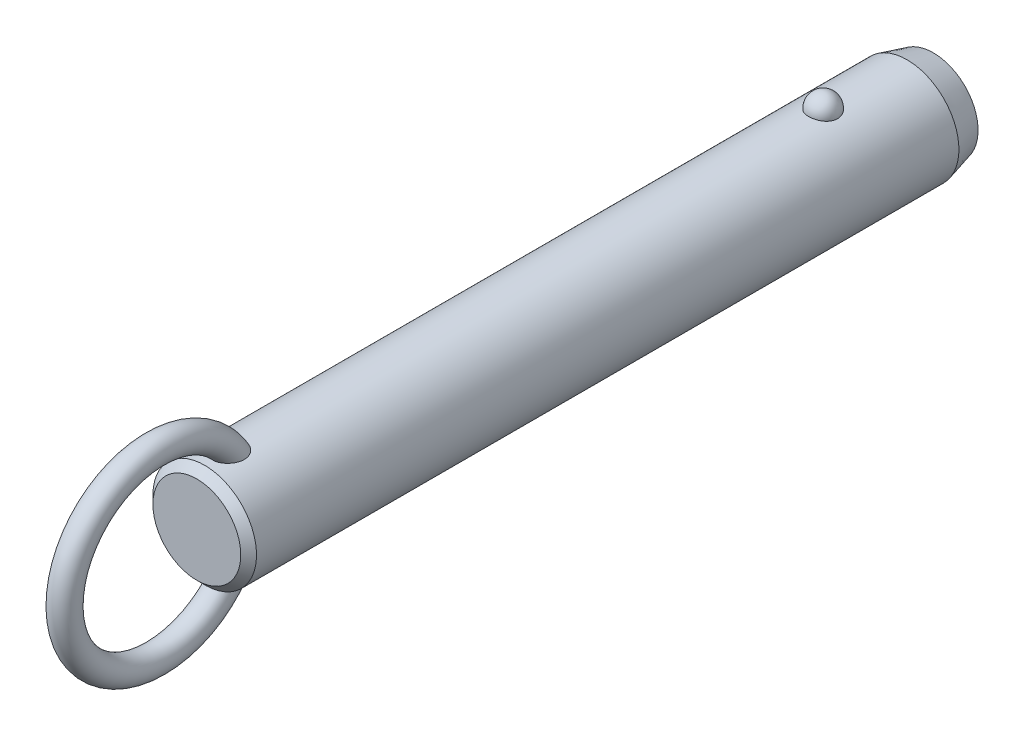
SolidWorks part; units mm, degrees
ref_plane "Front Plane" through (0, 0, 0) normal (0, 0, 1) x (1, 0, 0)
ref_plane "Top Plane" through (0, 0, 0) normal (0, 1, 0) x (1, 0, 0)
ref_plane "Right Plane" through (0, 0, 0) normal (1, 0, 0) x (0, 0, -1)
sketch "Sketch2" plane through (0, 0, 0) normal (0, 0, 1) x (1, 0, 0)
  circle A0 centre (0, 0) radius 7.9
  point P3 (0, 7.9)
  dimension "D1" = 15.8
extrude "Boss-Extrude1" add sketch "Sketch2" along normal blind 83.8
sketch "Sketch3" plane through (0, 0, 0) normal (0, 0, -1) x (-1, 0, 0)
  circle A0 centre (0, 0) radius 7.9
  dimension "D1" = 15.8
extrude "Boss-Extrude2" add sketch "Sketch3" along normal blind 19
chamfer "Chamfer1" distance 4 angle 15 1 edges at (-7.9, 0, -19)
sketch "Sketch12" plane through (0, 0, 0) normal (1, 0, 0) x (0, 0, -1)
  line L0 (-83.8, 7.9) -> (-83.8, -7.9) construction
  point P0 (-83.8, 0)
sketch "Sketch13" plane through (0, 0, 0) normal (1, 0, 0) x (0, 0, -1)
  circle A0 centre (-99.65, 0) radius 15.85
  point P2 (-83.8, 0)
  dimension "D1" = 31.7
sketch "Sketch14" plane through (0, 0, 0) normal (0, 1, 0) x (1, 0, 0)
  circle A0 centre (0, -85.8) radius 2
  point P2 (0, -83.8)
  dimension "D1" = 4
sweep "Sweep1" add profiles "Sketch14" path "Sketch13"
sketch "Sketch15" plane through (0, 0, 83.8) normal (0, 0, 1) x (1, 0, 0)
  circle A0 centre (0, 0) radius 7.9
  dimension "D1" = 15.8
extrude "Boss-Extrude3" add sketch "Sketch15" along normal blind 9.52
chamfer "Chamfer2" distance 1.2 angle 45 1 edges at (7.9, 0, 93.32)
sketch "Sketch18" plane through (0, 0, 0) normal (1, 0, 0) x (0, 0, -1)
  line L0 (15, 7.9) -> (-85.9091, 7.9) construction
  line L1 (2.2, 10.1) -> (2.2, 5.7)
  line L2 (-85.9091, -7.9) -> (15, -7.9) construction
  arc A0 (2.2, 10.1) -> (2.2, 5.7) centre (2.2, 7.9) ccw
  point P4 (0, 7.9)
  dimension "D1" = 18
revolve "Revolve1" add sketch "Sketch18" angle 360 about L1
